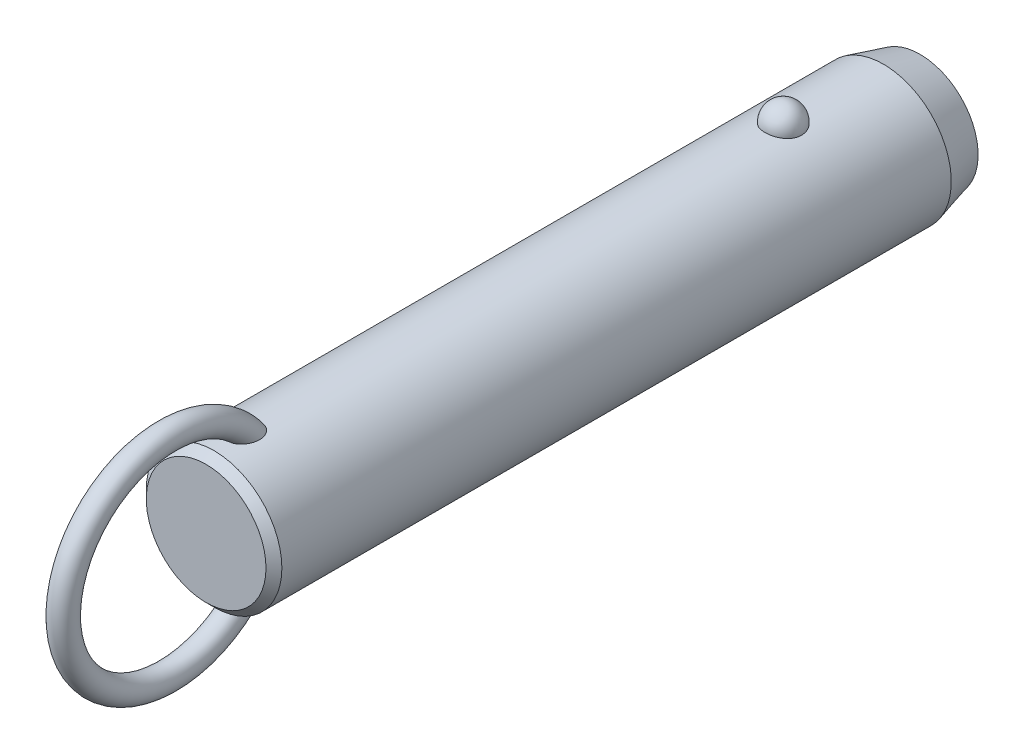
SolidWorks part; units mm, degrees
ref_plane "Front Plane" through (0, 0, 0) normal (0, 0, 1) x (1, 0, 0)
ref_plane "Top Plane" through (0, 0, 0) normal (0, 1, 0) x (1, 0, 0)
ref_plane "Right Plane" through (0, 0, 0) normal (1, 0, 0) x (0, 0, -1)
sketch "Sketch2" plane through (0, 0, 0) normal (0, 0, 1) x (1, 0, 0)
  circle A0 centre (0, 0) radius 11.1
  point P3 (0, 11.1)
  dimension "D1" = 22.2
extrude "Boss-Extrude1" add sketch "Sketch2" along normal blind 78.8
sketch "Sketch3" plane through (0, 0, 0) normal (0, 0, -1) x (-1, 0, 0)
  circle A0 centre (0, 0) radius 11.1
  dimension "D1" = 22.2
extrude "Boss-Extrude2" add sketch "Sketch3" along normal blind 25.4
chamfer "Chamfer1" distance 6 angle 15 1 edges at (-11.1, 0, -25.4)
sketch "Sketch12" plane through (0, 0, 0) normal (1, 0, 0) x (0, 0, -1)
  line L0 (-78.8, 11.1) -> (-78.8, -11.1) construction
  point P0 (-78.8, 0)
sketch "Sketch13" plane through (0, 0, 0) normal (1, 0, 0) x (0, 0, -1)
  circle A0 centre (-97.85, 0) radius 19.05
  point P2 (-78.8, 0)
  dimension "D1" = 38.1
sketch "Sketch14" plane through (0, 0, 0) normal (0, 1, 0) x (1, 0, 0)
  circle A0 centre (0, -80.8) radius 2
  point P2 (0, -78.8)
  dimension "D1" = 4
sweep "Sweep1" add profiles "Sketch14" path "Sketch13"
sketch "Sketch15" plane through (0, 0, 78.8) normal (0, 0, 1) x (1, 0, 0)
  circle A0 centre (0, 0) radius 11.1
  dimension "D1" = 22.2
extrude "Boss-Extrude3" add sketch "Sketch15" along normal blind 12.7
chamfer "Chamfer2" distance 1.3 angle 45 1 edges at (11.1, 0, 91.5)
sketch "Sketch18" plane through (0, 0, 0) normal (1, 0, 0) x (0, 0, -1)
  line L0 (19.4, 11.1) -> (-82.368, 11.1) construction
  line L1 (3, 14.1) -> (3, 8.1)
  line L2 (-82.368, -11.1) -> (19.4, -11.1) construction
  arc A0 (3, 14.1) -> (3, 8.1) centre (3, 11.1) ccw
  point P4 (0, 11.1)
  dimension "D1" = 25.2
revolve "Revolve1" add sketch "Sketch18" angle 360 about L1
